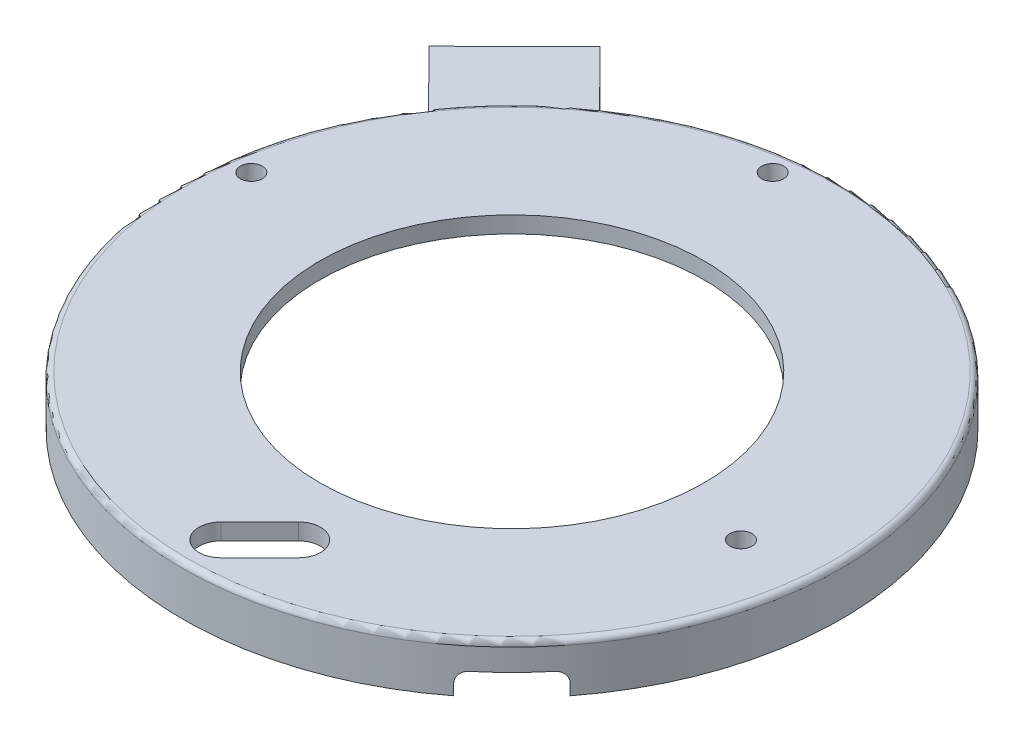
SolidWorks part; units mm, degrees
ref_plane "前视基准面" through (0, 0, 0) normal (0, 0, 1) x (1, 0, 0)
ref_plane "上视基准面" through (0, 0, 0) normal (0, 1, 0) x (1, 0, 0)
ref_plane "右视基准面" through (0, 0, 0) normal (1, 0, 0) x (0, 0, -1)
sketch "草图1" plane through (0, 0, 0) normal (0, 1, 0) x (1, 0, 0)
  line L0 (0, 0) -> (-97.7719, 0) construction
  line L1 (0, 0) -> (-79.0949, 79.0949) construction
  circle A0 centre (0, 0) radius 58
  dimension "D1" = 116
  dimension "D3" = 45
extrude "凸台-拉伸1" add sketch "草图1" along normal blind 3
sketch "草图2" plane through (0, 3, 0) normal (0, 1, 0) x (1, 0, 0)
  circle A0 centre (0, 0) radius 60
  circle A1 centre (0, 0) radius 58
  circle A2 centre (0, 0) radius 58
  dimension "D2" = 120
  dimension "D1" = 0
extrude "凸台-拉伸3" add sketch "草图2" against normal blind 9 separate body
sketch "草图9" plane through (0, 0, 0) normal (0, -1, 0) x (1, 0, 0)
  line L0 (-64.3883, 31.1557) -> (-52.0087, -39.0525) construction
  line L1 (-78.3206, -45.0847) -> (-0.4868, -58.8089) construction
  line L2 (0, 0) -> (-81.2838, 0) construction
  line L3 (0, 0) -> (0, -68.3259) construction
  line L4 (-45.8838, 74.9866) -> (60.9796, 41.7918) construction
  line L5 (42.935, 57.2993) -> (45.481, 49.103) construction
  line L6 (0, 0) -> (74.1735, 74.1735) construction
  line L7 (17.3027, 64.7217) -> (73.0685, 8.9559) construction
  circle A0 centre (0, 0) radius 58 construction
  circle A2 centre (0, 0) radius 58 construction
  point P17 (46.3394, 46.3394)
  point P20 (17.2055, 55.3893)
  dimension "D1" = 80
  dimension "D2" = 80
  dimension "D3" = 45
  dimension "D4" = 27
ref_plane "基准面10" through (41.0122, 0, 41.0122) normal (-0.7071, 0, -0.7071) x (0.7071, 0, -0.7071)
sketch "草图15" plane through (41.0122, 0, 41.0122) normal (-0.7071, 0, -0.7071) x (0.7071, 0, -0.7071)
  line L0 (-177093.2306, 0) -> (177021.3301, 0) construction
  line L3 (58, 6) -> (-58, 6) construction
  line L4 (-7.5, 10) -> (7.5, 10)
  line L11 (-7.5, 10) -> (-7.5, 4)
  line L12 (-5.5, 2) -> (5.5, 2)
  line L13 (7.5, 10) -> (7.5, 4)
  line L14 (-7.5, 10) -> (7.5, 2) construction
  line L15 (-7.5, 2) -> (7.5, 10) construction
  arc A0 (5.5, 2) -> (7.5, 4) centre (5.5, 4) ccw
  arc A1 (-7.5, 4) -> (-5.5, 2) centre (-5.5, 4) ccw
  point P0 (0, 10)
  point P7 (0, 6)
  dimension "D6" = 2
  dimension "D3" = 10
  dimension "D4" = 8
  dimension "D5" = 15
extrude "切除-拉伸5" cut sketch "草图15" against normal up to next and the other way up to next
sketch "草图16" plane through (0, 0, 0) normal (0, -1, 0) x (1, 0, 0)
  line L0 (0, 0) -> (74.1735, 74.1735) construction
  circle A0 centre (28.2843, 28.2843) radius 2.5
  dimension "D1" = 5
  dimension "D2" = 40
extrude "凸台-拉伸4" add sketch "草图16" along normal blind 3
sketch "草图17" plane through (0, -3, 0) normal (0, -1, 0) x (1, 0, 0)
  circle A0 centre (28.2843, 28.2843) radius 2
  dimension "D1" = 4
extrude "凸台-拉伸5" add sketch "草图17" along normal blind 4
fillet "圆角1" radius 1 1 edges at (0, 3, 60)
sketch "草图19" plane through (0, -6, 0) normal (0, -1, 0) x (1, 0, 0)
  line L0 (0, 0) -> (-61.2285, -61.2285) construction
  line L1 (0, 0) -> (74.1735, 74.1735) construction
  line L2 (-49.3394, -34.1412) -> (-59.9008, -44.7929)
  line L3 (-59.9008, -44.7929) -> (-44.2597, -60.2952)
  line L4 (-44.2597, -60.2952) -> (-33.7004, -49.6415)
  line L5 (-49.3394, -34.1412) -> (-33.7004, -49.6415)
  arc A0 (36.7903, 47.3969) -> (47.3969, 36.7903) centre (0, 0) ccw construction
  point P5 (-42.4264, -42.4264)
  dimension "D1" = 22.022
  dimension "D2" = 15
extrude "凸台-拉伸6" add sketch "草图19" against normal blind 5 and the other way blind 3 from offset 3
sketch "草图20" plane through (0, 3, 0) normal (0, 1, 0) x (1, 0, 0)
  line L0 (0, -200000) -> (0, 200068.3259) construction
  line L1 (200000, 0) -> (-200081.2838, 0) construction
  line L2 (0, -53) -> (53, 0) construction
  line L3 (0, -53) -> (7.0711, -45.9289) construction
  line L4 (-2.8284, -50.1716) -> (4.2426, -43.1005)
  line L5 (2.8284, -55.8284) -> (9.8995, -48.7574)
  circle A0 centre (0, 53) radius 2.1 construction
  circle A1 centre (-53, 0) radius 2.1 construction
  circle A2 centre (53, 0) radius 2.1 construction
  circle A3 centre (0, -53) radius 2.1 construction
  circle A4 centre (47.3431, -5.6569) radius 2
  circle A8 centre (-53, 0) radius 8 construction
  circle A9 centre (0, 53) radius 8 construction
  circle A10 centre (-55.1703, 7.7) radius 2
  circle A11 centre (-7.7, 55.1703) radius 2
  arc A12 (-2.8284, -50.1716) -> (2.8284, -55.8284) centre (0, -53) ccw
  arc A13 (9.8995, -48.7574) -> (4.2426, -43.1005) centre (7.0711, -45.9289) ccw
  point P15 (3.5355, -49.4645)
  dimension "D1" = 4.2
  dimension "D6" = 4
  dimension "D9" = 16
  dimension "D11" = 7.7
  dimension "D13" = 4
  dimension "D12" = 7.7
  dimension "D10" = 4
  dimension "D2" = 53
  dimension "D3" = 53
  dimension "D4" = 53
  dimension "D5" = 53
  dimension "D7" = 8
  dimension "D8" = 10
extrude "切除-拉伸7" cut sketch "草图20" against normal through all
sketch "草图21" plane through (0, 3, 0) normal (0, 1, 0) x (1, 0, 0)
  circle A0 centre (0, 0) radius 35
  dimension "D1" = 70
extrude "切除-拉伸8" cut sketch "草图21" against normal blind 10
